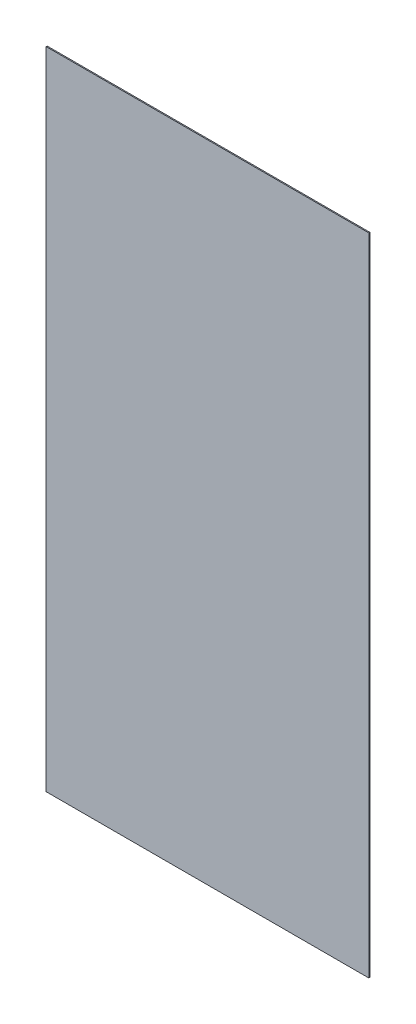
SolidWorks part; units mm, degrees
ref_plane "Front Plane" through (0, 0, 0) normal (0, 0, 1) x (1, 0, 0)
ref_plane "Top Plane" through (0, 0, 0) normal (0, 1, 0) x (1, 0, 0)
ref_plane "Right Plane" through (0, 0, 0) normal (1, 0, 0) x (0, 0, -1)
sketch "Sketch1" plane through (0, 0, 0) normal (0, 0, 1) x (1, 0, 0)
  line L1 (0, 0) -> (1220, 0)
  line L2 (0, 0) -> (0, 2440)
  line L3 (0, 2440) -> (1220, 2440)
  line L4 (1220, 0) -> (1220, 2440)
  dimension "D1" = 1220
  dimension "D2" = 2440
extrude "Boss-Extrude1" add sketch "Sketch1" along normal blind 4
